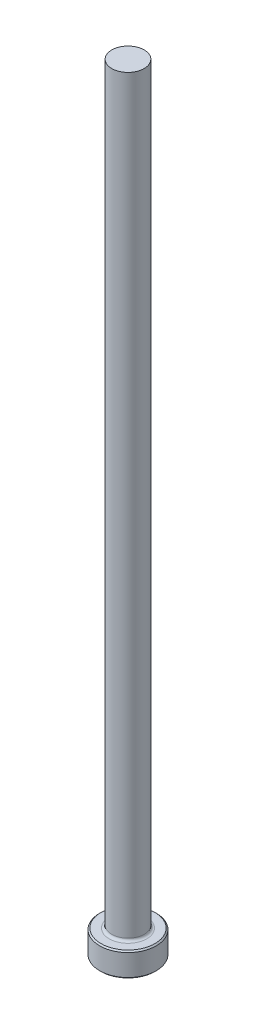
SolidWorks part; units mm, degrees
ref_plane "Front Plane" through (0, 0, 0) normal (0, 0, 1) x (1, 0, 0)
ref_plane "Top Plane" through (0, 0, 0) normal (0, 1, 0) x (1, 0, 0)
ref_plane "Right Plane" through (0, 0, 0) normal (1, 0, 0) x (0, 0, -1)
sketch "Sketch1" plane through (0, 0, 0) normal (0, 0, 1) x (1, 0, 0)
  line L0 (0, 259.9588) -> (0, -15.1925) construction
  line L1 (0, 0) -> (-5.5499, 0)
  line L2 (-5.5499, 0) -> (-5.5499, 4.7498)
  line L3 (-5.5499, 4.7498) -> (-3.175, 4.7498)
  line L4 (-3.175, 4.7498) -> (-3.175, 152.4)
  line L5 (-3.175, 152.4) -> (0, 152.4)
  line L6 (0, 152.4) -> (0, 0)
  dimension "L" = 152.4
  dimension "H" = 11.0998
  dimension "T" = 4.7498
  dimension "D" = 6.35
revolve "Revolve1" add sketch "Sketch1" angle 360 about L0
chamfer "Chamfer1" distance 0.254 angle 45 2 edges at (0, 4.7498, 5.5499) (0, 0, 5.5499)
fillet "Fillet1" radius 0.508 1 edges at (0, 4.7498, 3.175)
sketch "Pocket Sketch" plane through (0, 0, 0) normal (0, 0, 1) x (1, 0, 0)
  line L0 (-5.9468, 0) -> (-5.9468, 4.7752)
  line L1 (-5.9468, 4.7752) -> (-4.3339, 4.7752)
  line L2 (-3.5719, 5.5372) -> (-3.5719, 22.225)
  line L3 (-3.5719, 22.225) -> (0, 22.225)
  line L4 (0, 22.225) -> (0, 0)
  line L5 (0, 0) -> (-5.9468, 0)
  line L6 (0, 12.6104) -> (0, -2.4989) construction
  line L7 (-5.5499, 4.4958) -> (-5.5499, 0.254) construction
  line L8 (5.2959, 4.7498) -> (-5.2959, 4.7498) construction
  line L9 (-3.175, 152.4) -> (-3.175, 5.2578) construction
  line L10 (-4.3339, 4.7752) -> (-3.5719, 5.5372)
  point P3 (-3.5719, 4.7752)
  dimension "D1" = 11.8935
  dimension "D2" = 0.3969
  dimension "D3" = 0.0254
  dimension "D4" = 0.3969
  dimension "D5" = 7.1437
  dimension "D6" = 22.225
